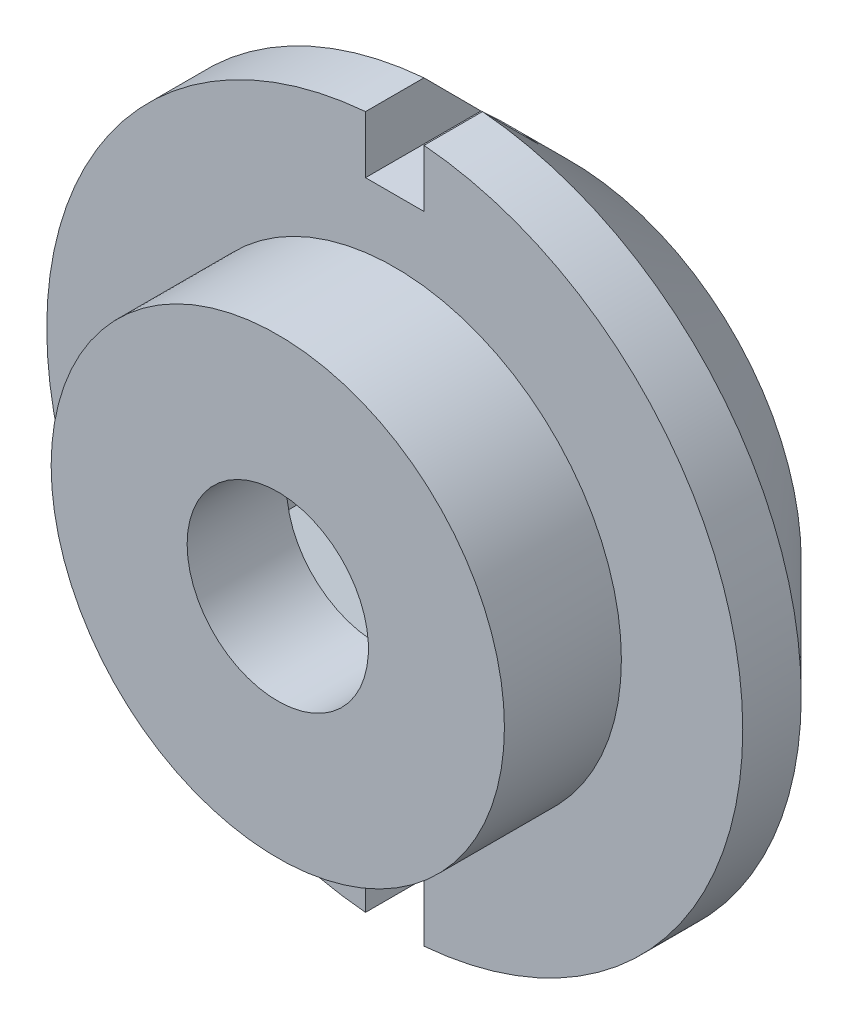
SolidWorks part; units mm, degrees
ref_plane "Alzado" through (0, 0, 0) normal (0, 0, 1) x (1, 0, 0)
ref_plane "Planta" through (0, 0, 0) normal (0, 1, 0) x (1, 0, 0)
ref_plane "Vista lateral" through (0, 0, 0) normal (1, 0, 0) x (0, 0, -1)
sketch "Croquis1" plane through (0, 0, 0) normal (0, 0, 1) x (1, 0, 0)
  circle A0 centre (0, 0) radius 5.95
  dimension "D1" = 11.9
extrude "Saliente-Extruir1" add sketch "Croquis1" along normal mid plane 3
sketch "Croquis2" plane through (0, 0, 1.5) normal (0, 0, 1) x (1, 0, 0)
  circle A0 centre (0, 0) radius 3.875
  dimension "D1" = 7.75
extrude "Saliente-Extruir2" add sketch "Croquis2" along normal blind 2
chamfer "Chaflán1" distance 2 angle 45 1 edges at (5.95, 0, -1.5)
sketch "Croquis3" plane through (0, 0, -1.5) normal (0, 0, -1) x (-1, 0, 0)
  line L1 (0, 3.25) -> (-2.8146, 1.625)
  line L2 (-2.8146, 1.625) -> (-2.8146, -1.625)
  line L3 (-2.8146, -1.625) -> (0, -3.25)
  line L4 (0, -3.25) -> (2.8146, -1.625)
  line L5 (2.8146, -1.625) -> (2.8146, 1.625)
  line L6 (2.8146, 1.625) -> (0, 3.25)
  circle A0 centre (0, 0) radius 2.8146 construction
  dimension "D1" = 6.5
extrude "Cortar-Extruir1" cut sketch "Croquis3" against normal blind 3.3
sketch "Croquis4" plane through (0, 0, 1.8) normal (0, 0, -1) x (-1, 0, 0)
  circle A0 centre (0, 0) radius 1.55
  dimension "D1" = 3.1
extrude "Cortar-Extruir2" cut sketch "Croquis4" against normal through all
sketch "Croquis5" plane through (0, 0, -1.5) normal (0, 0, -1) x (-1, 0, 0)
  line L6 (-0.5, -4.95) -> (0.5, -4.95)
  line L12 (-0.5, -4.95) -> (-0.5, -6.95)
  line L13 (-0.5, -6.95) -> (0.5, -6.95)
  line L14 (0.5, -4.95) -> (0.5, -6.95)
  line L15 (-0.5, -4.95) -> (0.5, -6.95) construction
  line L16 (-0.5, -6.95) -> (0.5, -4.95) construction
  line L17 (-0.5, 6.95) -> (0.5, 6.95)
  line L18 (-0.5, 6.95) -> (-0.5, 4.95)
  line L19 (-0.5, 4.95) -> (0.5, 4.95)
  line L20 (0.5, 6.95) -> (0.5, 4.95)
  line L21 (-0.5, 6.95) -> (0.5, 4.95) construction
  line L22 (-0.5, 4.95) -> (0.5, 6.95) construction
  circle A3 centre (0, 0) radius 5.95 construction
  point P0 (0, -5.95)
  point P7 (0, 5.95)
  dimension "D1" = 1
  dimension "D2" = 2
extrude "Cortar-Extruir3" cut sketch "Croquis5" against normal through all
